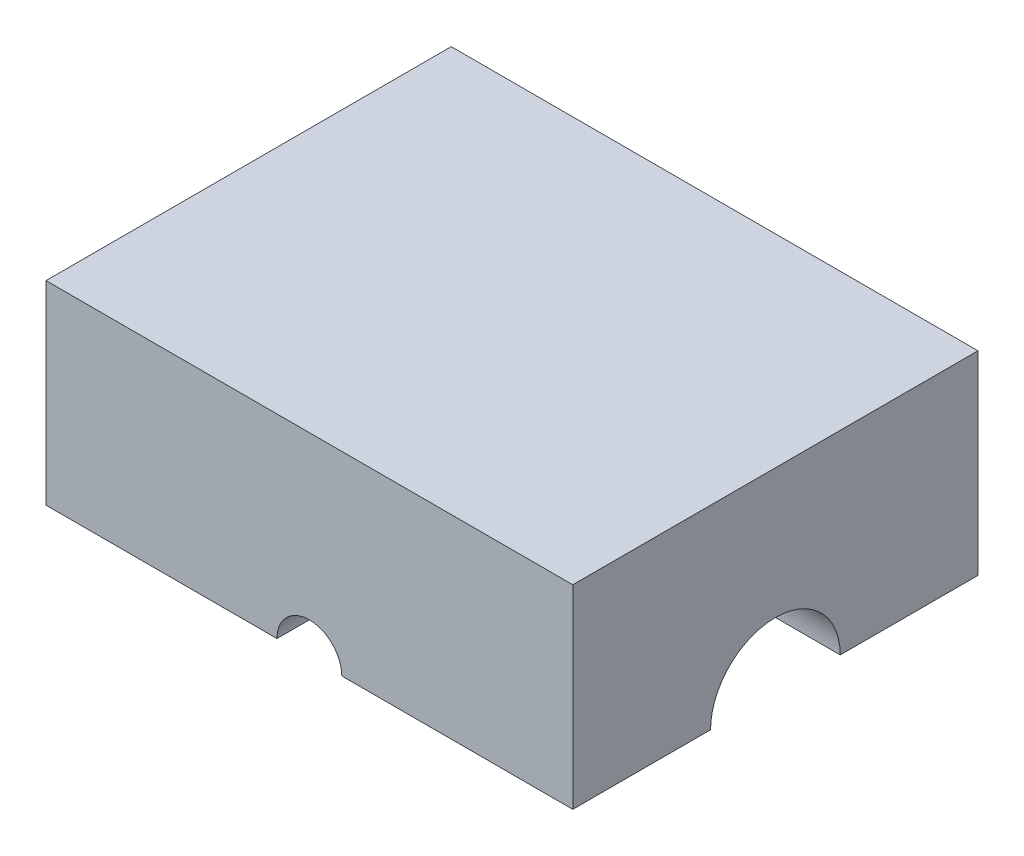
SolidWorks part; units mm, degrees
ref_plane "Front Plane" through (0, 0, 0) normal (0, 0, 1) x (1, 0, 0)
ref_plane "Top Plane" through (0, 0, 0) normal (0, 1, 0) x (1, 0, 0)
ref_plane "Right Plane" through (0, 0, 0) normal (1, 0, 0) x (0, 0, -1)
sketch "Sketch1" plane through (0, 0, 0) normal (0, 1, 0) x (1, 0, 0)
  line L1 (-206.375, -158.75) -> (206.375, -158.75)
  line L2 (-206.375, -158.75) -> (-206.375, 158.75)
  line L3 (-206.375, 158.75) -> (206.375, 158.75)
  line L4 (206.375, -158.75) -> (206.375, 158.75)
  line L5 (-206.375, -158.75) -> (206.375, 158.75) construction
  line L6 (-206.375, 158.75) -> (206.375, -158.75) construction
  point P0 (0, 0)
  dimension "D1" = 412.75
  dimension "D2" = 317.5
extrude "Boss-Extrude1" add sketch "Sketch1" along normal blind 152.4
sketch "Sketch2" plane through (0, 0, 0) normal (0, -1, 0) x (1, 0, 0)
  line L0 (0, 158.75) -> (25.4, 158.75)
  line L1 (-206.375, 158.75) -> (206.375, 158.75) construction
  line L2 (25.4, 158.75) -> (25.4, 95.25)
  line L3 (25.4, 95.25) -> (76.2, 95.25)
  line L4 (76.2, 95.25) -> (76.2, -95.25)
  line L5 (76.2, -95.25) -> (25.4, -95.25)
  line L6 (25.4, -95.25) -> (25.4, -158.75)
  line L7 (206.375, -158.75) -> (-206.375, -158.75) construction
  line L8 (25.4, -158.75) -> (0, -158.75)
  line L9 (0, -158.75) -> (0, 158.75)
  line L10 (0, 158.75) -> (0, 173.2848) construction
  line L11 (0, 173.2848) -> (0, -167.7587) construction
  dimension "D1" = 25.4
  dimension "D2" = 76.2
  dimension "D3" = 63.5
revolve "Cut-Revolve1" cut sketch "Sketch2" angle 360 about L9
sketch "Sketch3" plane through (0, 0, 0) normal (1, 0, 0) x (0, 0, -1)
  circle A0 centre (0, 0) radius 50.8
  dimension "D1" = 101.6
extrude "Cut-Extrude1" cut sketch "Sketch3" against normal through all and the other way through all
fillet "Fillet1" radius 25.4 2 edges at (-56.8622, 50.7261, 2.74) (56.8622, 50.7261, -2.74)
